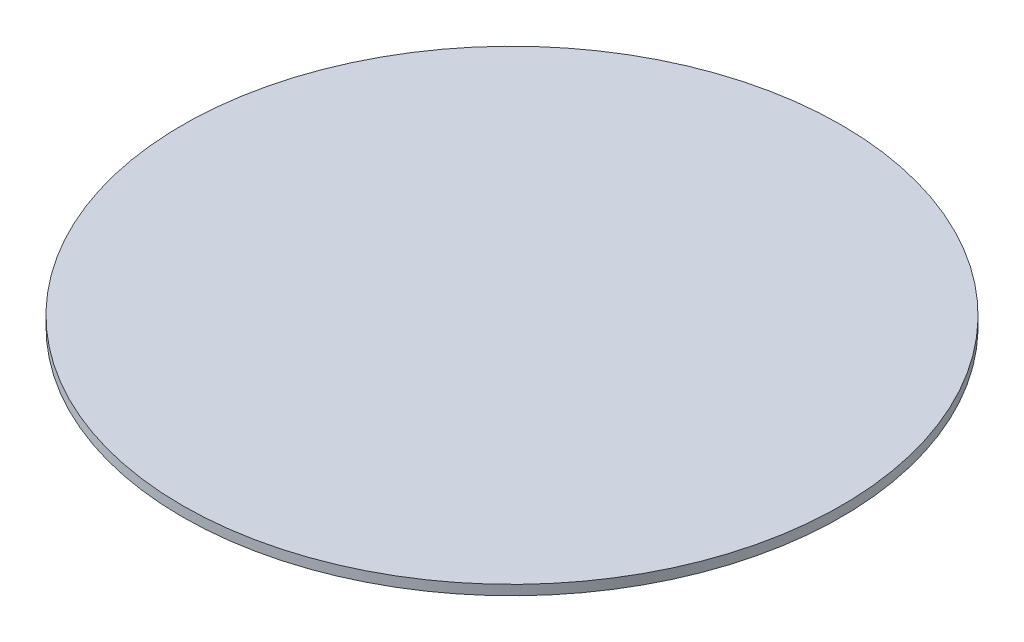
SolidWorks part; units mm, degrees
ref_plane "Plan de face" through (0, 0, 0) normal (0, 0, 1) x (1, 0, 0)
ref_plane "Plan de dessus" through (0, 0, 0) normal (0, 1, 0) x (1, 0, 0)
ref_plane "Plan de droite" through (0, 0, 0) normal (1, 0, 0) x (0, 0, -1)
sketch "Esquisse1" plane through (0, 0, 0) normal (0, 1, 0) x (1, 0, 0)
  circle A0 centre (0, 0) radius 100
  dimension "D1" = 200
extrude "Extrusion1" add sketch "Esquisse1" along normal blind 3
